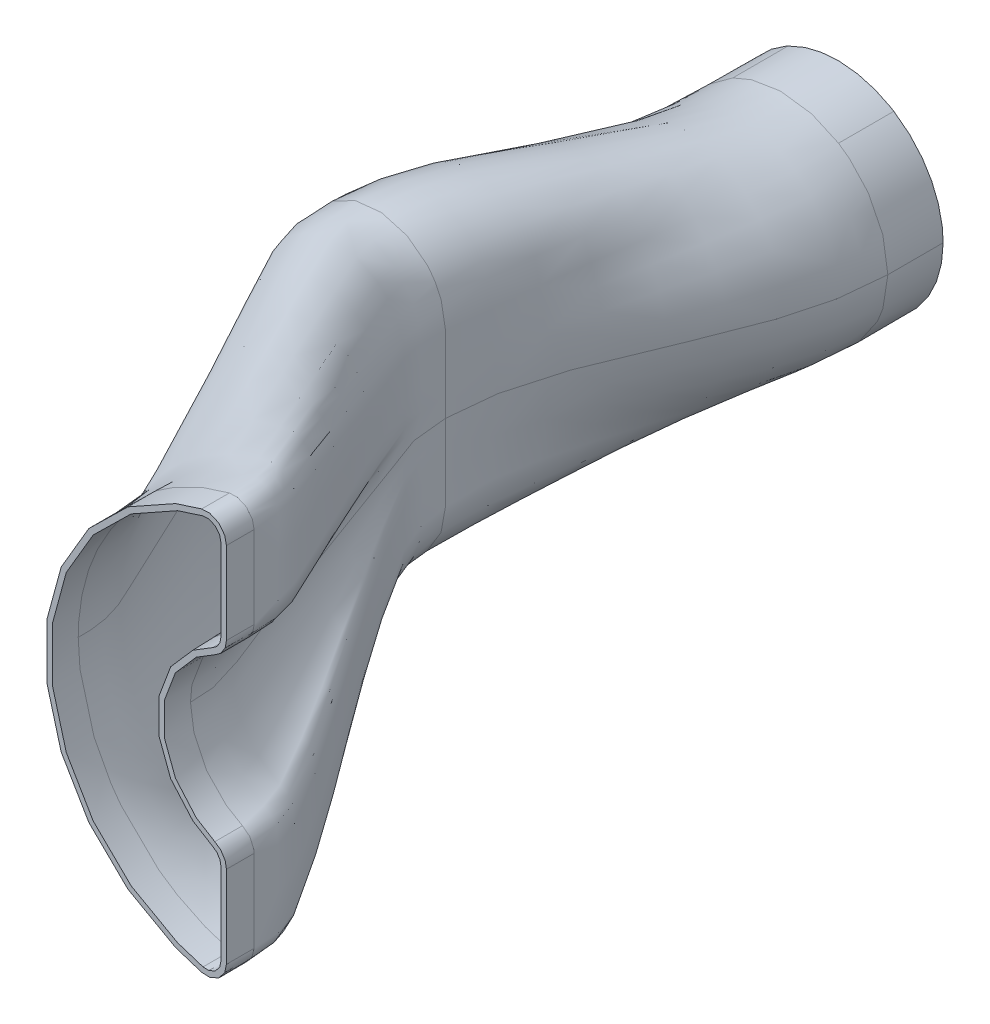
SolidWorks part; units mm, degrees
ref_plane "Front" through (0, 0, 0) normal (0, 0, 1) x (1, 0, 0)
ref_plane "Top" through (0, 0, 0) normal (0, 1, 0) x (1, 0, 0)
ref_plane "Right" through (0, 0, 0) normal (1, 0, 0) x (0, 0, -1)
ref_plane "rec" through (0, 0, -135) normal (0, 0, 1) x (1, 0, 0)
ref_plane "rnd" through (0, 0, -260) normal (0, 0, 1) x (1, 0, 0)
sketch "rough target" plane through (0, 0, 0) normal (0, 1, 0) x (1, 0, 0)
  line L0 (-7.6292, 0) -> (-132.6559, 233.5912)
  line L1 (-76, 0) -> (-140.9177, 214.909)
  line L3 (-113.1606, 123.0197) -> (-73.4739, 123.0197)
  line L4 (-129.2875, -26.448) -> (-129.2875, -58.4649)
sketch "D" plane through (0, 0, 0) normal (0, 0, 1) x (1, 0, 0)
  line L0 (-9.2, 65.5805) -> (-9.2, 35.8246)
  line L1 (0, 0) -> (0, 21.114) construction
  line L2 (0, 0) -> (17.171, 0) construction
  line L4 (-74.8, 0) -> (-32.2, 0)
  arc A0 (-13.403, 29.278) -> (-32.2, 0) centre (0, 0) ccw
  arc A1 (-18.1467, 72.5654) -> (-74.8, 0) centre (0, 0) ccw
  arc A4 (-13.403, 29.278) -> (-9.2, 35.8246) centre (-16.4, 35.8246) ccw
  arc A5 (-9.2, 65.5805) -> (-18.1467, 72.5654) centre (-16.4, 65.5805) ccw
  point P12 (-9.2, -30.8577)
  point P17 (-55.6331, -50)
  point P18 (-55.6331, 50)
  dimension "D1" = 149.6
  dimension "D2" = 64.4
  dimension "D4" = 7.2
  dimension "D3" = 9.2
  dimension "D5" = 100
sketch "s rec" plane through (0, 0, -135) normal (0, 0, 1) x (1, 0, 0)
  line L0 (0, 0) -> (17.171, 0) construction
  line L1 (-125.5776, 27.7112) -> (-75, 27.7112) construction
  line L2 (-125.5776, 27.7112) -> (-125.5776, -27.7112) construction
  line L3 (-125.5776, -27.7112) -> (-75, -27.7112) construction
  line L4 (-75, 27.7112) -> (-75, 0)
  line L5 (-128, 0) -> (-75, 0)
  line L6 (-129.036, 53) -> (-100.2888, 53) construction
  line L7 (-100.2888, -53) -> (-120.6205, -53) construction
  line L8 (-100.2888, 27.7112) -> (-100.2888, -27.7112) construction
  line L9 (0, 0) -> (0, 21.114) construction
  line L10 (57, 0) -> (57, 29.4496) construction
  line L11 (-75, 27.7112) -> (-75, -27.7112) construction
  line L12 (0, 0) -> (-16.4915, 0) construction
  arc A0 (-75, 27.7112) -> (-125.5776, 27.7112) centre (-100.2888, 27.7112) ccw construction
  arc A1 (-125.5776, -27.7112) -> (-75, -27.7112) centre (-100.2888, -27.7112) ccw construction
  arc A2 (-125.194, 32.099) -> (-128, 0) centre (57, 0) ccw
  arc A3 (-75, 27.7112) -> (-125.194, 32.099) centre (-100.2888, 27.7112) ccw
  point P8 (-100.2888, 27.7112)
  point P23 (-100.2888, 0)
  dimension "D3" = 185
  dimension "D1" = 75
  dimension "D2" = 106
  dimension "D4" = 57
sketch "loft" plane through (0, 0, 0) normal (0, 1, 0) x (1, 0, 0)
  line L0 (-74.8, 0) -> (-74.8, 2)
  line L1 (-128, 135) -> (-128, 133)
  line L2 (-78.6027, 19.0222) -> (-124.1973, 115.9778)
  line L3 (-74.8, 0) -> (-18.1467, 0) construction
  arc A0 (-128, 133) -> (-124.1973, 115.9778) centre (-88, 133) ccw
  arc A1 (-78.6027, 19.0222) -> (-74.8, 2) centre (-114.8, 2) cw
  dimension "D1" = 40
  dimension "D2" = 2
loft "Loft1" add profiles "s rec", "D"
sketch "Sketch6" plane through (0, 0, -135) normal (0, 0, -1) x (-1, 0, 0)
  line L0 (128, 0) -> (75, 0) construction
  line L1 (75, 27.7112) -> (75, 0) construction
  line L2 (128, 0) -> (75, 0)
  line L3 (75, 27.7112) -> (75, 0)
  arc A0 (128, 0) -> (125.194, 32.099) centre (-57, 0) ccw construction
  arc A1 (125.194, 32.099) -> (75, 27.7112) centre (100.2888, 27.7112) ccw construction
  arc A2 (128, 0) -> (125.194, 32.099) centre (-57, 0) ccw
  arc A3 (125.194, 32.099) -> (75, 27.7112) centre (100.2888, 27.7112) ccw
sketch "s rnd" plane through (0, 0, -260) normal (0, 0, 1) x (1, 0, 0)
  line L0 (0, 0) -> (17.171, 0) construction
  line L1 (-40, 12.2937) -> (-40, -12.2937) construction
  line L2 (0, 0) -> (-11.2667, 0) construction
  line L3 (0, 0) -> (0, 21.114) construction
  line L4 (-40, 0) -> (-116.2, 0)
  arc A0 (-40, 0) -> (-116.2, 0) centre (-78.1, 0) ccw
  point P6 (-40, 0)
  dimension "D1" = 76.2
  dimension "D2" = 40
loft "Loft2" add profiles "Sketch6", "s rnd"
mirror "Mirror1" about plane through (0, 0, 0) normal (0, 1, 0)
sketch "Sketch7" plane through (0, 0, 0) normal (0, 0, 1) x (1, 0, 0)
  line L2 (-9.2, 35.8246) -> (-9.2, 65.5805) construction
  line L3 (-9.2, -35.8246) -> (-9.2, -65.5805) construction
  line L4 (-9.2, 35.8246) -> (-9.2, 65.5805)
  line L5 (-9.2, -35.8246) -> (-9.2, -65.5805)
  arc A9 (-13.403, 29.278) -> (-9.2, 35.8246) centre (-16.4, 35.8246) ccw construction
  arc A10 (-13.403, 29.278) -> (-32.2, 0) centre (0, 0) ccw construction
  arc A11 (-32.2, 0) -> (-13.403, -29.278) centre (0, 0) ccw construction
  arc A12 (-9.2, -35.8246) -> (-13.403, -29.278) centre (-16.4, -35.8246) ccw construction
  arc A13 (-18.1467, -72.5654) -> (-9.2, -65.5805) centre (-16.4, -65.5805) ccw construction
  arc A14 (-37.9761, -64.4427) -> (-18.1467, -72.5654) centre (0, 0) ccw construction
  arc A15 (-62.7055, -40.7807) -> (-37.9761, -64.4427) centre (0, 0) ccw construction
  arc A16 (-74.8, 0) -> (-62.7055, -40.7807) centre (0, 0) ccw construction
  arc A17 (-62.7055, 40.7807) -> (-74.8, 0) centre (0, 0) ccw construction
  arc A18 (-37.9761, 64.4427) -> (-62.7055, 40.7807) centre (0, 0) ccw construction
  arc A19 (-18.1467, 72.5654) -> (-37.9761, 64.4427) centre (0, 0) ccw construction
  arc A20 (-9.2, 65.5805) -> (-18.1467, 72.5654) centre (-16.4, 65.5805) ccw construction
  arc A21 (-13.403, 29.278) -> (-9.2, 35.8246) centre (-16.4, 35.8246) ccw
  arc A22 (-13.403, 29.278) -> (-32.2, 0) centre (0, 0) ccw
  arc A23 (-32.2, 0) -> (-13.403, -29.278) centre (0, 0) ccw
  arc A24 (-9.2, -35.8246) -> (-13.403, -29.278) centre (-16.4, -35.8246) ccw
  arc A25 (-18.1467, -72.5654) -> (-9.2, -65.5805) centre (-16.4, -65.5805) ccw
  arc A26 (-37.9761, -64.4427) -> (-18.1467, -72.5654) centre (0, 0) ccw
  arc A27 (-62.7055, -40.7807) -> (-37.9761, -64.4427) centre (0, 0) ccw
  arc A28 (-74.8, 0) -> (-62.7055, -40.7807) centre (0, 0) ccw
  arc A29 (-62.7055, 40.7807) -> (-74.8, 0) centre (0, 0) ccw
  arc A30 (-37.9761, 64.4427) -> (-62.7055, 40.7807) centre (0, 0) ccw
  arc A31 (-18.1467, 72.5654) -> (-37.9761, 64.4427) centre (0, 0) ccw
  arc A32 (-9.2, 65.5805) -> (-18.1467, 72.5654) centre (-16.4, 65.5805) ccw
extrude "Boss-Extrude3" add sketch "Sketch7" along normal blind 10
sketch "Sketch8" plane through (0, 0, -260) normal (0, 0, -1) x (-1, 0, 0)
  spline S0 degree 3 poles (790.6515, 753.0181) (14.8936, -78.1055) (51.4646, 68.422) (103.1709, 28.8165) (106.668, 25.3803) (109.9189, 21.1935) (112.6914, 16.3084) (114.7521, 10.9235) (127.76, -49.0649) (2.0011, -83.1663) (323.9486, 978.1697) knots -1.452555 -1.452555 -1.452555 -1.452555 0.035868 0.071736 0.107604 0.143472 0.179341 0.215209 0.251077 1.33893 1.33893 1.33893 1.33893 only from (96.1037, 33.5779) to (116.2, 0) construction
  spline S1 degree 3 poles (-444.7647, -832.2534) (-14.4592, -49.1731) (33.9707, 21.2075) (62.8947, 34.9669) (65.2916, 35.9127) (67.2479, 36.537) (68.7973, 36.9531) (70.3379, 37.3156) (72.2503, 37.6719) (74.5337, 37.956) (76.8134, 38.1007) (79.0973, 38.1101) (81.3934, 37.9808) (83.3236, 37.7547) (84.8831, 37.4975) (86.4546, 37.1876) (88.4447, 36.6981) (90.8937, 35.9193) (120.8962, 24.0775) (174.0174, -43.4408) (653.3704, -796.7245) knots -0.627704 -0.627704 -0.627704 -0.627704 0.315343 0.343742 0.37214 0.400539 0.414738 0.428937 0.457335 0.485734 0.514132 0.542531 0.570929 0.599327 0.613527 0.627726 0.656124 0.684523 0.712921 1.666614 1.666614 1.666614 1.666614 only from (57.834, 32.263) to (96.1037, 33.5779) construction
  spline S2 degree 3 poles (-420.4746, 887.6706) (149.8596, -55.3) (29.6524, -48.5702) (41.2256, 10.0899) (43.0514, 15.272) (45.5543, 20.0384) (48.4913, 24.1389) (51.6212, 27.5106) (97.7442, 67.0036) (120.1368, -69.1129) (-477.792, 876.7046) knots -0.251047 -0.251047 -0.251047 -0.251047 0.773655 0.80599 0.838325 0.87066 0.902995 0.93533 0.967665 2.321718 2.321718 2.321718 2.321718 only from (40, 0) to (57.834, 32.263) construction
  spline S3 degree 2 poles (982.7642, 333.4586) (23.0931, 130.7887) (40.3032, -4.797) (40.6065, -7.1865) (41.208, -9.5177) (41.8097, -11.85) (42.6999, -14.087) (43.5905, -16.3249) (44.7553, -18.432) (45.9205, -20.54) (47.3413, -22.4836) (48.7627, -24.4281) (50.4169, -26.1774) (52.0719, -27.9275) (53.9331, -29.4546) (159.6818, -116.2165) (839.5234, 591.396) knots -6.971891 -6.971891 -6.971891 0.125 0.125 0.25 0.25 0.375 0.375 0.5 0.5 0.625 0.625 0.75 0.75 0.875 0.875 7.97611 7.97611 7.97611 only from (40, 0) to (57.834, -32.263) construction
  spline S4 degree 2 poles (274.8355, 943.907) (-62.1012, 22.2659) (62.2438, -34.6438) (64.5277, -35.689) (66.9279, -36.4252) (69.3292, -37.1617) (71.8053, -37.5764) (74.2825, -37.9914) (76.7917, -38.0775) (79.3019, -38.1637) (81.8006, -37.9199) (84.3004, -37.6759) (86.7455, -37.1061) (89.1917, -36.5361) (91.5409, -35.6504) (219.5955, 12.6308) (-56.5213, 954.6953) knots -6.684337 -6.684337 -6.684337 0.125 0.125 0.25 0.25 0.375 0.375 0.5 0.5 0.625 0.625 0.75 0.75 0.875 0.875 7.688068 7.688068 7.688068 only from (57.834, -32.263) to (96.1037, -33.5779) construction
  spline S5 degree 2 poles (-645.587, 637.1638) (-10.32, -111.114) (100.4539, -30.8531) (102.5374, -29.3435) (104.3983, -27.5683) (106.26, -25.7923) (107.8653, -23.7831) (109.4714, -21.773) (110.7921, -19.5662) (112.1134, -17.3584) (113.1255, -14.9941) (114.1381, -12.6288) (114.8232, -10.1499) (115.5086, -7.6699) (115.8542, -5.1214) (134.2538, 130.5316) (-826.4166, 333.8537) knots -6.524396 -6.524396 -6.524396 0.125 0.125 0.25 0.25 0.375 0.375 0.5 0.5 0.625 0.625 0.75 0.75 0.875 0.875 7.527886 7.527886 7.527886 only from (96.1037, -33.5779) to (116.2, 0) construction
  spline S6 degree 3 poles (96.1037, 33.5779) (97.2581, 32.959) (99.6047, 31.5481) (103.1709, 28.8165) (106.668, 25.3803) (109.9189, 21.1935) (112.6914, 16.3084) (114.7521, 10.9235) (115.9592, 5.3568) (116.2, 1.7437) (116.2, 0) knots 0 0 0 0 0.035868 0.071736 0.107604 0.143472 0.179341 0.215209 0.251077 0.286945 0.286945 0.286945 0.286945
  spline S7 degree 3 poles (57.834, 32.263) (58.7176, 32.818) (60.4301, 33.7945) (62.8947, 34.9669) (65.2916, 35.9127) (67.2479, 36.537) (68.7973, 36.9531) (70.3379, 37.3156) (72.2503, 37.6719) (74.5337, 37.956) (76.8134, 38.1007) (79.0973, 38.1101) (81.3934, 37.9808) (83.3236, 37.7547) (84.8831, 37.4975) (86.4546, 37.1876) (88.4447, 36.6981) (90.8937, 35.9193) (93.4232, 34.9209) (95.1897, 34.068) (96.1037, 33.5779) knots 0.286945 0.286945 0.286945 0.286945 0.315343 0.343742 0.37214 0.400539 0.414738 0.428937 0.457335 0.485734 0.514132 0.542531 0.570929 0.599327 0.613527 0.627726 0.656124 0.684523 0.712921 0.74132 0.74132 0.74132 0.74132
  spline S8 degree 3 poles (40, 0) (40, 1.5719) (40.1951, 4.8664) (41.2256, 10.0899) (43.0514, 15.272) (45.5543, 20.0384) (48.4913, 24.1389) (51.6212, 27.5106) (54.7748, 30.2109) (56.8279, 31.631) (57.834, 32.263) knots 0.74132 0.74132 0.74132 0.74132 0.773655 0.80599 0.838325 0.87066 0.902995 0.93533 0.967665 1 1 1 1
  spline S9 degree 2 poles (40, 0) (40.0001, -2.4089) (40.3032, -4.797) (40.6065, -7.1865) (41.208, -9.5177) (41.8097, -11.85) (42.6999, -14.087) (43.5905, -16.3249) (44.7553, -18.432) (45.9205, -20.54) (47.3413, -22.4836) (48.7627, -24.4281) (50.4169, -26.1774) (52.0719, -27.9275) (53.9331, -29.4546) (55.7946, -30.9819) (57.834, -32.263) knots 0 0 0 0.125 0.125 0.25 0.25 0.375 0.375 0.5 0.5 0.625 0.625 0.75 0.75 0.875 0.875 1 1 1
  spline S10 degree 2 poles (57.834, -32.263) (59.9612, -33.5991) (62.2438, -34.6438) (64.5277, -35.689) (66.9279, -36.4252) (69.3292, -37.1617) (71.8053, -37.5764) (74.2825, -37.9914) (76.7917, -38.0775) (79.3019, -38.1637) (81.8006, -37.9199) (84.3004, -37.6759) (86.7455, -37.1061) (89.1917, -36.5361) (91.5409, -35.6504) (93.8903, -34.7646) (96.1037, -33.5779) knots 0 0 0 0.125 0.125 0.25 0.25 0.375 0.375 0.5 0.5 0.625 0.625 0.75 0.75 0.875 0.875 1 1 1
  spline S11 degree 2 poles (96.1037, -33.5779) (98.3715, -32.3619) (100.4539, -30.8531) (102.5374, -29.3435) (104.3983, -27.5683) (106.26, -25.7923) (107.8653, -23.7831) (109.4714, -21.773) (110.7921, -19.5662) (112.1134, -17.3584) (113.1255, -14.9941) (114.1381, -12.6288) (114.8232, -10.1499) (115.5086, -7.6699) (115.8542, -5.1214) (116.1999, -2.5727) (116.2, 0) knots 0 0 0 0.125 0.125 0.25 0.25 0.375 0.375 0.5 0.5 0.625 0.625 0.75 0.75 0.875 0.875 1 1 1
extrude "Boss-Extrude4" add sketch "Sketch8" along normal blind 20
shell "Shell1" thickness 2
